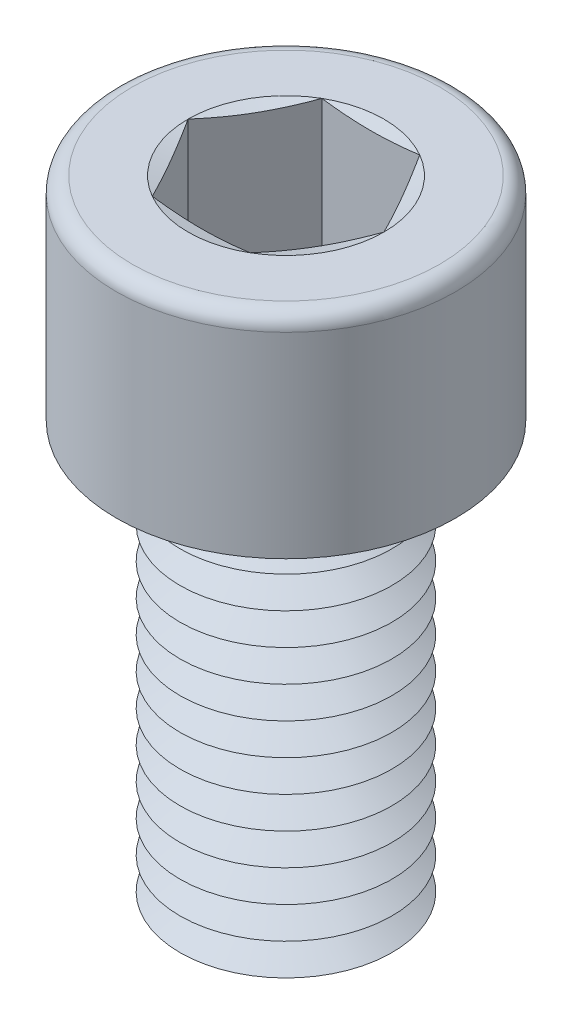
SolidWorks part; units mm, degrees
ref_plane "Front Plane" through (0, 0, 0) normal (0, 0, 1) x (1, 0, 0)
ref_plane "Top Plane" through (0, 0, 0) normal (0, 1, 0) x (1, 0, 0)
ref_plane "Right Plane" through (0, 0, 0) normal (1, 0, 0) x (0, 0, -1)
sketch "Sketch1" plane through (0, 0, 0) normal (0, 1, 0) x (1, 0, 0)
  circle A0 centre (0, 0) radius 5
  dimension "D1" = 10
extrude "Extrude1" add sketch "Sketch1" along normal blind 20
sketch "Sketch2" plane through (0, 20, 0) normal (0, 1, 0) x (1, 0, 0)
  circle A0 centre (0, 0) radius 8
  dimension "D1" = 16
extrude "Extrude2" add sketch "Sketch2" along normal blind 10
sketch "Sketch3" plane through (0, 30, 0) normal (0, 1, 0) x (1, 0, 0)
  line L1 (2.3094, 4) -> (-2.3094, 4)
  line L2 (-2.3094, 4) -> (-4.6188, 0)
  line L3 (-4.6188, 0) -> (-2.3094, -4)
  line L4 (-2.3094, -4) -> (2.3094, -4)
  line L5 (2.3094, -4) -> (4.6188, 0)
  line L6 (4.6188, 0) -> (2.3094, 4)
  circle A0 centre (0, 0) radius 4 construction
  dimension "D1" = 8
extrude "Extrude3" cut sketch "Sketch3" against normal blind 8
fillet "Fillet1" radius 0.75 1 edges at (0, 30, 8)
sketch "Sketch4" plane through (0, 0, 0) normal (1, 0, 0) x (0, 0, -1)
  line L0 (-4, 22) -> (0, 22)
  line L1 (0, 22) -> (0, 19.6906)
  line L2 (0, 19.6906) -> (-4, 22)
  dimension "D1" = 30
revolve "Cut-Revolve1" cut sketch "Sketch4" angle 360 about L1
sketch "Sketch5" plane through (0, 0, 0) normal (0, 0, 1) x (1, 0, 0)
  line L0 (-5, 0.75) -> (-5, -0.75)
  line L1 (-5, 20) -> (-5, 0) construction
  line L2 (-5, -0.75) -> (-3.701, 0)
  line L3 (-5, 0) -> (5, 0) construction
  line L4 (-3.701, 0) -> (-5, 0.75)
  dimension "D1" = 1.5
revolve "Cut-Revolve2" cut sketch "Sketch5" angle 360 about axis through (0, 20, 0) along (0, -1, 0)
pattern_linear "LPattern1" count 13 spacing 1.5 along (0, 1, 0) of "Cut-Revolve2"
sketch "Sketch6" plane through (0, 30, 0) normal (0, 1, 0) x (1, 0, 0)
  circle A0 centre (0, 0) radius 4.6188
extrude "Extrude4" cut sketch "Sketch6" against normal through all draft 75
